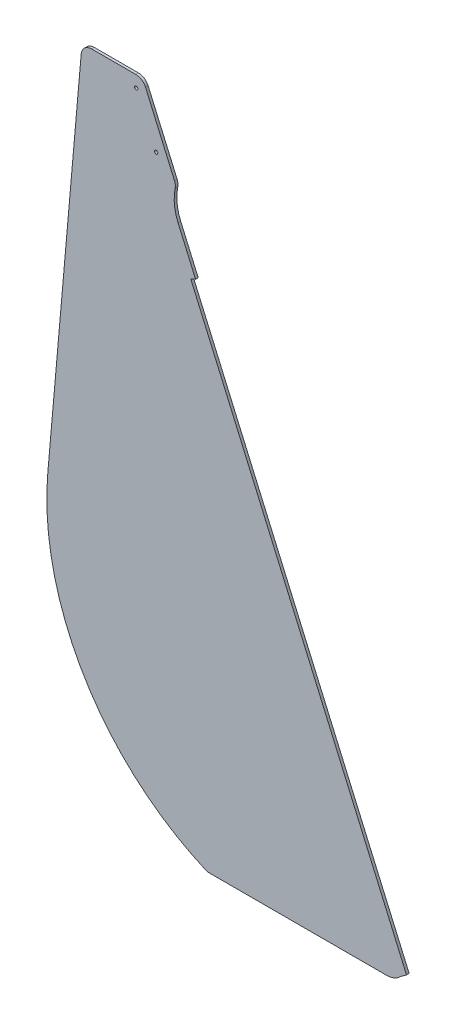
SolidWorks part; units mm, degrees
ref_plane "Front Plane" through (0, 0, 0) normal (0, 0, 1) x (1, 0, 0)
ref_plane "Top Plane" through (0, 0, 0) normal (0, 1, 0) x (1, 0, 0)
ref_plane "Right Plane" through (0, 0, 0) normal (1, 0, 0) x (0, 0, -1)
sketch "Sketch1" plane through (0, 0, 0) normal (0, 0, 1) x (1, 0, 0)
  line L0 (-126.8897, 291.0417) -> (-159.6138, 366.0997)
  line L1 (116.2771, -266.7) -> (0, 0)
  line L2 (0, 0) -> (-126.8897, 291.0417)
  line L3 (-276.1382, 483.7139) -> (-316.2764, 27.8476)
  line L4 (-124.4341, -292.1) -> (91.44, -292.1)
  line L5 (-115.248, 296.1173) -> (-204.3015, 500.3756) construction
  line L6 (107.3093, -285.4351) -> (120.261, -275.8378)
  line L9 (91.44, -269.875) -> (115.0238, -323.9683) construction
  line L11 (117.4707, -269.4377) -> (120.261, -275.8378)
  line L12 (116.2771, -266.7) -> (117.4707, -269.4377)
  line L14 (-263.4871, 495.3) -> (-210.4062, 495.3)
  line L15 (-126.8897, 291.0417) -> (-215.9432, 495.3) construction
  line L16 (-163.9706, 407.8701) -> (-198.7645, 487.6756)
  arc A0 (-159.6138, 366.0997) -> (-163.1737, 400.2305) centre (-107.6032, 388.7755) cw
  arc A1 (-163.1737, 400.2305) -> (-163.9706, 407.8701) centre (-175.6122, 402.7945) ccw
  arc A2 (-316.2764, 27.8476) -> (-124.4341, -292.1) centre (0, 0) ccw
  arc A3 (-263.4871, 495.3) -> (-276.1382, 483.7139) centre (-263.4871, 482.6) ccw
  arc A4 (-198.7645, 487.6756) -> (-210.4062, 495.3) centre (-210.4062, 482.6) ccw
  arc A5 (91.44, -292.1) -> (107.3093, -285.4351) centre (91.44, -269.875) ccw
  point P15 (91.44, -269.875)
  dimension "D1" = 292.1
  dimension "D4" = 12.7
  dimension "D6" = 635
  dimension "D7" = 25.4
  dimension "D8" = 44.45
  dimension "D9" = 25.4
  dimension "D2" = 269.875
  dimension "D3" = 787.4
  dimension "D5" = 91.44
  dimension "D10" = 143.461
extrude "Boss-Extrude2" add sketch "Sketch1" along normal blind 3.175
sketch "Sketch4" plane through (0, 0, 3.175) normal (0, 0, 1) x (1, 0, 0)
  line L0 (-185.9693, 426.55) -> (-215.9432, 495.3) construction
  line L1 (-210.4062, 495.3) -> (-263.4871, 495.3) construction
  line L2 (0, 0) -> (-185.9693, 426.55) construction
  line L3 (-185.9693, 426.55) -> (-209.9484, 481.55) construction
  circle A0 centre (-185.9693, 426.55) radius 2
  circle A1 centre (-209.9484, 481.55) radius 2
  dimension "D3" = 4
  dimension "D4" = 4
  dimension "D1" = 75
  dimension "D2" = 60
sketch "Sketch6" plane through (0, 0, 3.175) normal (0, 0, 1) x (1, 0, 0)
  line L0 (0, 0) -> (-34.925, -15.2268)
  line L1 (120.261, -275.8378) -> (-159.6138, 366.0997) construction
  circle A0 centre (-34.925, -15.2268) radius 3.175
  dimension "D3" = 6.35
  dimension "D1" = 90
  dimension "D2" = 38.1
extrude "Cut-Extrude1" cut sketch "Sketch4" against normal through all
sketch "Sketch7" plane through (0, 0, 0) normal (0.9167, 0.3997, 0) x (0, 0, -1)
  line L0 (-3.175, -300.9139) -> (-3.175, 399.3815) construction
  line L1 (0, -300.9139) -> (-3.175, -300.9139)
  line L2 (0, -300.9139) -> (0, 346.7861)
  line L3 (0, 346.7861) -> (-3.175, 346.7861)
  line L4 (-3.175, -300.9139) -> (-3.175, 346.7861)
  dimension "D1" = 647.7
extrude "Cut-Extrude2" cut sketch "Sketch7" against normal blind 6.35
sketch "Sketch10" plane through (120.261, -275.8378, 0) normal (-0.3997, 0.9167, 0) x (0.9167, 0.3997, 0)
  line L1 (-6.35, -3.175) -> (0, -3.175)
  line L2 (-6.35, -3.175) -> (-6.35, 0)
  line L3 (-6.35, 0) -> (0, 0)
  line L4 (0, -3.175) -> (0, 0)
extrude "Cut-Extrude5" cut sketch "Sketch10" against normal blind 635
